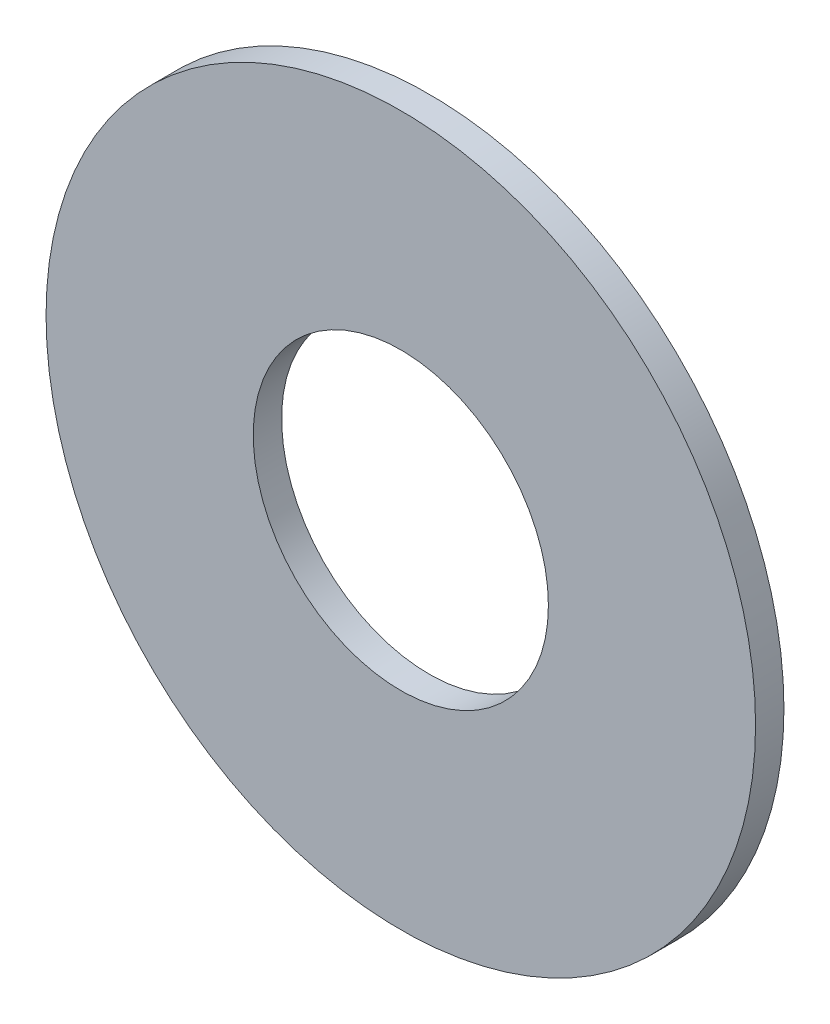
SolidWorks part; units mm, degrees
ref_plane "Plane1" through (0, 0, 0) normal (0, 0, 1) x (1, 0, 0)
ref_plane "Plane2" through (0, 0, 0) normal (0, 1, 0) x (1, 0, 0)
ref_plane "Plane3" through (0, 0, 0) normal (1, 0, 0) x (0, 0, -1)
sketch "Sketch1" plane through (0, 0, 0) normal (0, 0, 1) x (1, 0, 0)
  circle A0 centre (0, 0) radius 3.9624
  circle A1 centre (0, 0) radius 9.525
  dimension "D1" = 7.9248
  dimension "D2" = 19.05
extrude "Base-Extrude" add sketch "Sketch1" against normal blind 0.762
sketch "Sketch2" plane through (0, 0, 0) normal (0, 0, 1) x (1, 0, 0)
  line L0 (0, 3.9624) -> (0, 9.525) construction
  circle A0 centre (0, 0) radius 3.9624 construction
  circle A1 centre (0, 0) radius 9.525 construction
